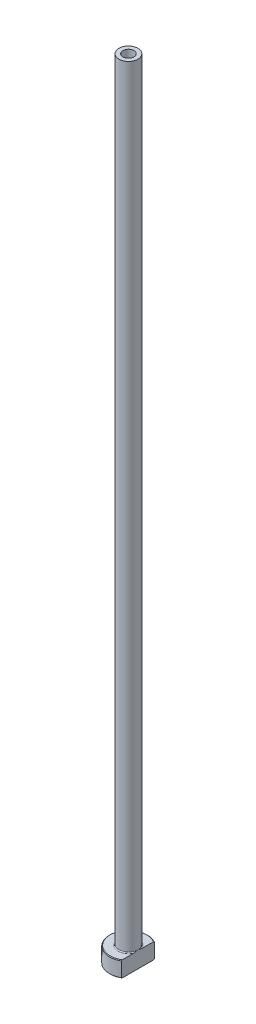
SolidWorks part; units mm, degrees
ref_plane "Front Plane" through (0, 0, 0) normal (0, 0, 1) x (1, 0, 0)
ref_plane "Top Plane" through (0, 0, 0) normal (0, 1, 0) x (1, 0, 0)
ref_plane "Right Plane" through (0, 0, 0) normal (1, 0, 0) x (0, 0, -1)
sketch "Sketch1" plane through (0, 0, 0) normal (0, 0, 1) x (1, 0, 0)
  line L0 (-1.75, 250) -> (-3, 250)
  line L1 (-3, 250) -> (-3, 5)
  line L2 (-3, 5) -> (-6, 5)
  line L3 (-6, 5) -> (-6, 0)
  line L4 (4.95, 0) -> (-4.95, 0) construction
  line L5 (-6, 0) -> (-2, 0)
  line L6 (-1.75, 205) -> (-1.75, 250)
  line L7 (0, 92.1877) -> (0, -15.5353) construction
  line L8 (0, -6.6) -> (0, 6.6) construction
  line L9 (-1.75, 205) -> (-2, 193)
  line L10 (-2, 193) -> (-2, 0)
  dimension "D1" = 0.25
  dimension "ID" = 3.5
  dimension "OD" = 6
  dimension "L" = 250
  dimension "H" = 12
  dimension "T" = 5
  dimension "N" = 45
  dimension "D2" = 12
  dimension "L-N" = 205
revolve "Revolve1" add sketch "Sketch1" angle 360 about L7
fillet "Fillet1" radius 0.3 1 edges at (0, 5, 3)
chamfer "Chamfer1" distance 0.2 angle 45 2 edges at (0, 5, 6) (0, 0, 6)
sketch "Sketch2" plane through (0, 0, 0) normal (0, -1, 0) x (1, 0, 0)
  line L0 (3, 5.1962) -> (3, -5.1962)
  circle A0 centre (0, 0) radius 6 construction
  arc A1 (3, 5.1962) -> (3, -5.1962) centre (0, 0) cw
  circle A2 centre (0, 0) radius 3 construction
extrude "Cut-Extrude1" cut sketch "Sketch2" against normal through all
chamfer "Chamfer2" distance 0.5 angle 45 1 edges at (0, 0, 2)
